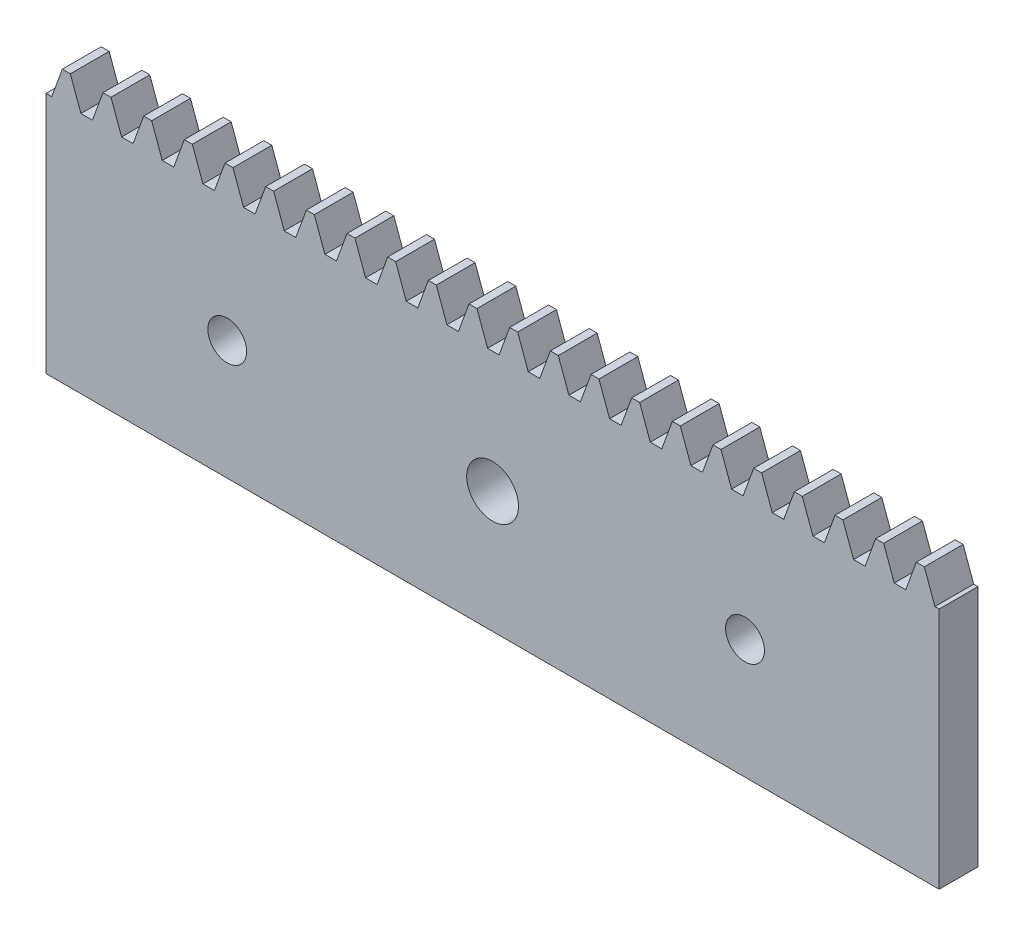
SolidWorks part; units mm, degrees
extrude "Blank" add sketch "BlankSke" against normal blind 3
sketch "BlankSke" plane through (0, 0, 0) normal (0, 0, 1) x (1, 0, 0)
  line L1 (0, 0) -> (69, 0)
  line L2 (0, 0) -> (0, 21)
  line L3 (0, 21) -> (69, 21)
  line L4 (69, 0) -> (69, 21)
ref_plane "Plane1" through (0, 0, 0) normal (0, 0, 1) x (1, 0, 0)
ref_plane "Plane2" through (0, 0, 0) normal (0, 1, 0) x (1, 0, 0)
ref_plane "Plane3" through (0, 0, 0) normal (1, 0, 0) x (0, 0, -1)
sketch "HoldingSke" plane through (0, 0, 0) normal (0, 1, 0) x (1, 0, 0)
  line L0 (0, 0) -> (0.1392, 0.9903)
  line L1 (-15, 0) -> (100, 0) construction
  line L2 (0, 0) -> (-2.1039, 2.3779)
  line L3 (0, 0) -> (-11.863, 4.5341)
  line L4 (0, 0) -> (7.9495, 3.3743)
  line L5 (0, 0) -> (-23.7986, -8.8762)
  line L6 (0, 0) -> (-10.5278, -7.1032)
  line L9 (-71.009, 38.7566) -> (-6.1702, 62.356)
  line L10 (-76.2, 3.3779) -> (-56.2, 3.3779)
  line L11 (0, 0) -> (-3, 0)
  line L12 (-76.2, 101.6) -> (-76.162, 101.6)
  line L13 (24.9733, 27.94) -> (52.9518, 28.4284)
  line L14 (24.9733, 27.94) -> (24.9743, 27.94)
  line L15 (24.9733, 27.94) -> (100.4006, 29.5858)
  circle A0 centre (0, 0) radius 19.05
  circle A1 centre (0, 0) radius 10
  circle A2 centre (0, 0) radius 12.7
sketch "TooCutSkeIll" plane through (0, 0, 0) normal (0, 0, 1) x (1, 0, 0)
  line L0 (-1.2538, 20.9737) -> (-0.5045, 18.9152)
  line L1 (-0.2687, 18.75) -> (0.2687, 18.75)
  line L2 (0.5045, 18.9152) -> (1.2538, 20.9737)
  line L3 (69, 21) -> (0, 21) construction
  line L4 (0, 0) -> (0, 64.897) construction
  line L5 (-13.208, 20) -> (12.954, 20) construction
  line L6 (0, 0) -> (69, 0) construction
  line L7 (0.8994, 20) -> (0.8994, 48.7463) construction
  line L8 (-0.8994, 20) -> (-0.8994, 48.7463) construction
  line L9 (1.2914, 21) -> (1.2914, 21.0254)
  line L10 (-1.2914, 21) -> (-1.2914, 21.0254)
  line L11 (-1.2914, 21.0254) -> (1.2914, 21.0254)
  arc A0 (0.2687, 18.75) -> (0.5045, 18.9152) centre (0.2687, 19.001) ccw
  arc A1 (-0.5045, 18.9152) -> (-0.2687, 18.75) centre (-0.2687, 19.001) ccw
  arc A2 (1.2914, 21) -> (1.2538, 20.9737) centre (1.2914, 20.96) ccw
  arc A3 (-1.2538, 20.9737) -> (-1.2914, 21) centre (-1.2914, 20.96) ccw
extrude "ToothCutIll" [suppressed] cut sketch "TooCutSkeIll" against normal through all
sketch "TooCutSkeSim" plane through (0, 0, 0) normal (0, 0, 1) x (1, 0, 0)
  line L0 (0.4444, 18.75) -> (-0.4444, 18.75)
  line L1 (1.2726, 21.0254) -> (0.4444, 18.75)
  line L2 (0, 17.4625) -> (0, 53.467) construction
  line L3 (1.2726, 21.0254) -> (-1.2726, 21.0254)
  line L6 (-1.2726, 21.0254) -> (-0.4444, 18.75)
  line L9 (-0.8994, 20) -> (0.8994, 20) construction
  line L10 (0, 0) -> (69, 0) construction
  line L11 (0.8994, 20) -> (0.8994, 53.467) construction
  line L12 (-0.8994, 20) -> (-0.8994, 53.467) construction
extrude "ToothCutSim" cut sketch "TooCutSkeSim" against normal through all
pattern_linear "TeethCuts" count 23 spacing 3.1416 along (1, 0, 0) of "ToothCutIll", "ToothCutSim"
sketch "Sketch1" plane through (0, 0, 0) normal (0, 0, 1) x (1, 0, 0)
  line L0 (69, 0) -> (69, 18.75) construction
  circle A0 centre (14, 9.216) radius 1.5
  circle A1 centre (54, 9.216) radius 1.5
  point P4 (0, 0)
  point P5 (0, 0)
  point P6 (56.0706, 9.216)
  dimension "D1" = 3
  dimension "D2" = 40
  dimension "D3" = 15
extrude "Cut-Extrude1" cut sketch "Sketch1" against normal up to next
sketch "Sketch2" plane through (0, 0, 0) normal (0, 0, 1) x (1, 0, 0)
  line L0 (27.7388, 9.375) -> (43.423, 9.375) construction
  line L1 (34.5, 16.3714) -> (34.5, 4.7902) construction
  line L2 (0, 18.75) -> (0, 0) construction
  line L3 (69, 0) -> (69, 18.75) construction
  line L4 (27.8299, 18.75) -> (28.7188, 18.75) construction
  line L5 (0, 0) -> (69, 0) construction
  circle A0 centre (34.5, 9.375) radius 2
  dimension "D1" = 4
extrude "Cut-Extrude2" cut sketch "Sketch2" against normal up to next
equation "' \"Module@HoldingSke\" = 6.35"
equation "' \"Num_teeth@HoldingSke\" = 12"
equation "' \"Ap@HoldingSke\" =  20"
equation "' \"Ap@HoldingSke\" = 20"
equation "' \"Width@HoldingSke\" = 0.25 * 25.4"
equation "' \"Show_teeth@HoldingSke\" = 500"
equation "' \"Backlash@HoldingSke\" = 0.009 * 25.4"
equation "' \"Addendum_fac@HoldingSke\" = 1.0"
equation "' \"Dedendum_fac@HoldingSke\" = 1.25"
equation "' \"Dedendum_add@HoldingSke\" = 0.00005 * 25.4"
equation "' \"Clearance_fac@HoldingSke\" = 0.25"
equation "' \"Pitch_height@HoldingSke\" = 1 * 25.4"
equation "' \"Length@HoldingSke\" = 4.71 * 25.4"
equation "\"Pitch@HoldingSke\" = 1 / \"Module@HoldingSke\""
equation "\"MPH@HoldingSke\" = \"Dedendum_fac@HoldingSke\" / \"Pitch@HoldingSke\" + 2 * \"Dedendum_add@HoldingSke\" + 0.002 * 25.4"
equation "\"MPH@HoldingSke\" = ((sgn( \"MPH@HoldingSke\" - \"Pitch_height@HoldingSke\")+1)*( \"MPH@HoldingSke\" - \"Pitch_height@HoldingSke\"))/2 + \"Pitch_height@HoldingSke\""
equation "\"Blank_height@BlankSke\" = \"Pitch_height@HoldingSke\" + \"Addendum_fac@HoldingSke\"  / \"Pitch@HoldingSke\" "
equation "\"Length@BlankSke\" =  \"Length@HoldingSke\""
equation "\"Face_width@Blank\" = \"Width@HoldingSke\""
equation "\"Pressure_angle@TooCutSkeIll\" = \"Ap@HoldingSke\""
equation "\"Addendum_plus@TooCutSkeIll\" =  \"Addendum_fac@HoldingSke\"  / \"Pitch@HoldingSke\" + 0.001 *25.4"
equation "\"Dedendum@TooCutSkeIll\" = \"Dedendum_fac@HoldingSke\"  / \"Pitch@HoldingSke\""
equation "\"Pitch_height@TooCutSkeIll\" =  \"MPH@HoldingSke\""
equation "\"Gap_width@TooCutSkeIll\" = 3.14159265 / 2 / \"Pitch@HoldingSke\" + 6 * \"Backlash@HoldingSke\""
equation "\"Pressure_angle@TooCutSkeSim\" = \"Ap@HoldingSke\""
equation "\"Addendum_plus@TooCutSkeSim\" =  \"Addendum_fac@HoldingSke\"  / \"Pitch@HoldingSke\" + 0.001 * 25.4"
equation "\"Dedendum@TooCutSkeSim\" = \"Dedendum_fac@HoldingSke\"  / \"Pitch@HoldingSke\""
equation "\"Pitch_height@TooCutSkeSim\" =  \"MPH@HoldingSke\""
equation "\"Gap_width@TooCutSkeSim\" = 3.14159265 / 2 / \"Pitch@HoldingSke\" + 6 * \"Backlash@HoldingSke\""
equation "\"Root_fillet@TooCutSkeIll\" = \"Clearance_fac@HoldingSke\" / \"Pitch@HoldingSke\" + \"Dedendum_add@HoldingSke\""
equation "\"Break_rad@TooCutSkeIll\" = 0.02 / \"Pitch@HoldingSke\" * 2"
equation "\"Linear_pitch@TeethCuts\" = 3.14159265 / \"Pitch@HoldingSke\""
equation "\"Num_teeth@HoldingSke\" = int( ( \"Length@HoldingSke\" + 0 ) / (3.14159265 / \"Pitch@HoldingSke\")) + 0.9999  + 1"
equation " \"Num_teeth@TeethCuts\" = int( \"Show_teeth@HoldingSke\" ) + 1"
equation " \"Num_teeth@TeethCuts\" = ((sgn( \"Num_teeth@TeethCuts\" - \"Num_teeth@HoldingSke\" )-1)*( \"Num_teeth@TeethCuts\" - \"Num_teeth@HoldingSke\" ))/-2+ \"Num_teeth@HoldingSke\""
equation " \"Num_teeth@TeethCuts\" = ((sgn( \"Num_teeth@TeethCuts\" - 2.0)+1)*( \"Num_teeth@TeethCuts\" - 2.0))/2 +2.0"
